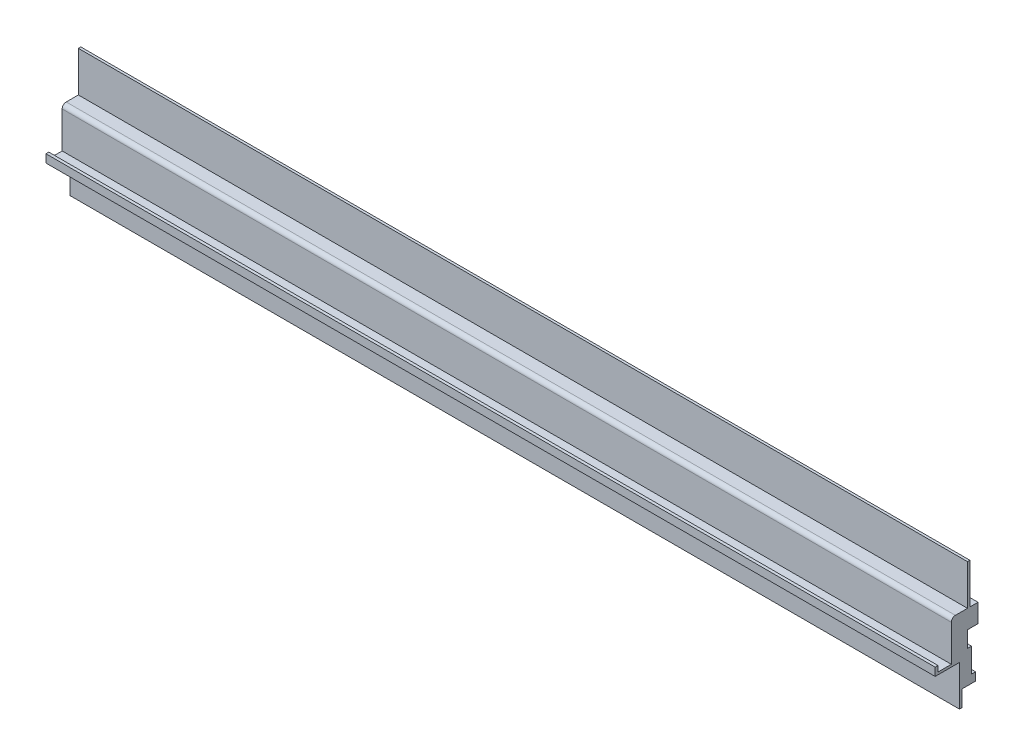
SolidWorks part; units mm, degrees
ref_plane "Front Plane" through (0, 0, 0) normal (0, 0, 1) x (1, 0, 0)
ref_plane "Top Plane" through (0, 0, 0) normal (0, 1, 0) x (1, 0, 0)
ref_plane "Right Plane" through (0, 0, 0) normal (1, 0, 0) x (0, 0, -1)
sketch "Sketch1" plane through (0, 0, 0) normal (1, 0, 0) x (0, 0, -1)
  line L0 (10, 34.5172) -> (10, -15.4828)
  line L1 (10, -15.4828) -> (-10, -15.4828)
  line L2 (-10, -15.4828) -> (-10, -65.4828)
  line L3 (-10, -65.4828) -> (-26.4956, -65.4828)
  line L5 (-26.4956, -65.4828) -> (-26.4956, -58.4828)
  line L6 (-26.4956, -58.4828) -> (-30, -58.4828)
  line L7 (-30, -58.4828) -> (-30, -68.4828)
  line L9 (-30, -68.4828) -> (0, -68.4828)
  line L10 (0, -68.4828) -> (0, -118.4828)
  line L11 (10, 34.5172) -> (13, 34.5172)
  line L12 (13, 34.5172) -> (13, -15.4828)
  line L14 (23, -15.4828) -> (23, -38.4828)
  line L16 (10, -38.4828) -> (10, -58.4828)
  line L18 (15, -58.4828) -> (15, -88.4828)
  line L19 (15, -88.4828) -> (20, -88.4828)
  line L20 (20, -88.4828) -> (20, -98.4828)
  line L24 (20, -98.4828) -> (3, -98.4828)
  line L26 (0, -118.4828) -> (3, -118.4828)
  line L27 (3, -118.4828) -> (3, -98.4828)
  line L28 (13, -15.4828) -> (23, -15.4828)
  line L29 (10, -58.4828) -> (15, -58.4828)
  line L30 (10, -38.4828) -> (23, -38.4828)
  dimension "D1" = 3
  dimension "D2" = 3.5044
  dimension "D3" = 20
  dimension "D4" = 50
  dimension "D5" = 50
  dimension "D6" = 3
  dimension "D7" = 5
  dimension "D8" = 30
  dimension "D9" = 10
  dimension "D10" = 20
  dimension "D11" = 3
  dimension "D12" = 5
  dimension "D13" = 20
  dimension "D14" = 10
  dimension "D15" = 30
  dimension "D16" = 10
extrude "Boss-Extrude1" add sketch "Sketch1" along normal mid plane 1100
fillet "Fillet1" radius 5 1 edges at (0, -15.4828, 10)
